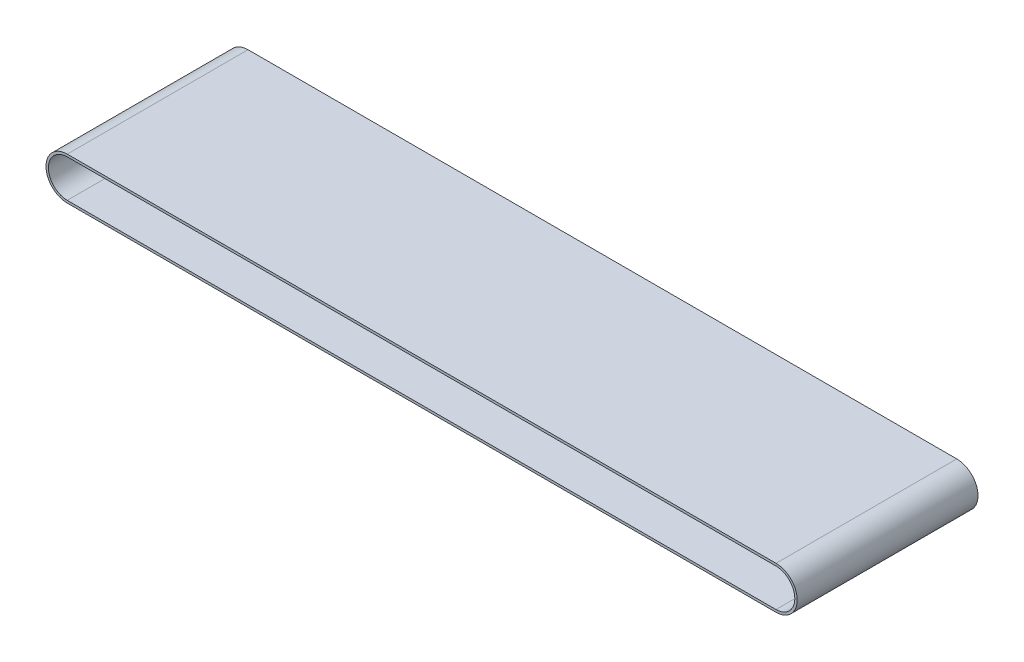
SolidWorks part; units mm, degrees
ref_plane "Front Plane" through (0, 0, 0) normal (0, 0, 1) x (1, 0, 0)
ref_plane "Top Plane" through (0, 0, 0) normal (0, 1, 0) x (1, 0, 0)
ref_plane "Right Plane" through (0, 0, 0) normal (1, 0, 0) x (0, 0, -1)
sketch "Sketch1" plane through (0, 0, 0) normal (0, 0, 1) x (1, 0, 0)
  line L0 (-486.0125, 20.9125) -> (-15.575, 20.9125) construction
  line L1 (-486.0125, 33.4125) -> (-15.575, 33.4125)
  line L2 (-486.0125, 8.4125) -> (-15.575, 8.4125)
  line L3 (-486.0125, 35) -> (-15.575, 35)
  line L4 (-486.0125, 6.825) -> (-15.575, 6.825)
  arc A0 (-486.0125, 33.4125) -> (-486.0125, 8.4125) centre (-486.0125, 20.9125) ccw
  arc A1 (-15.575, 8.4125) -> (-15.575, 33.4125) centre (-15.575, 20.9125) ccw
  arc A2 (-15.575, 6.825) -> (-15.575, 35) centre (-15.575, 20.9125) ccw
  arc A3 (-486.0125, 35) -> (-486.0125, 6.825) centre (-486.0125, 20.9125) ccw
  circle A4 centre (-486.0125, 20.9125) radius 3.175 construction
  circle A5 centre (-486.0125, 20.9125) radius 3.175
  point P2 (-250.7938, 20.9125)
  dimension "D1" = 12.5
  dimension "D2" = 1.5875
extrude "Boss-Extrude1" add sketch "Sketch1" along normal mid plane 120 contours L3 A3 L4 A2 A1 L2 A0 L1
